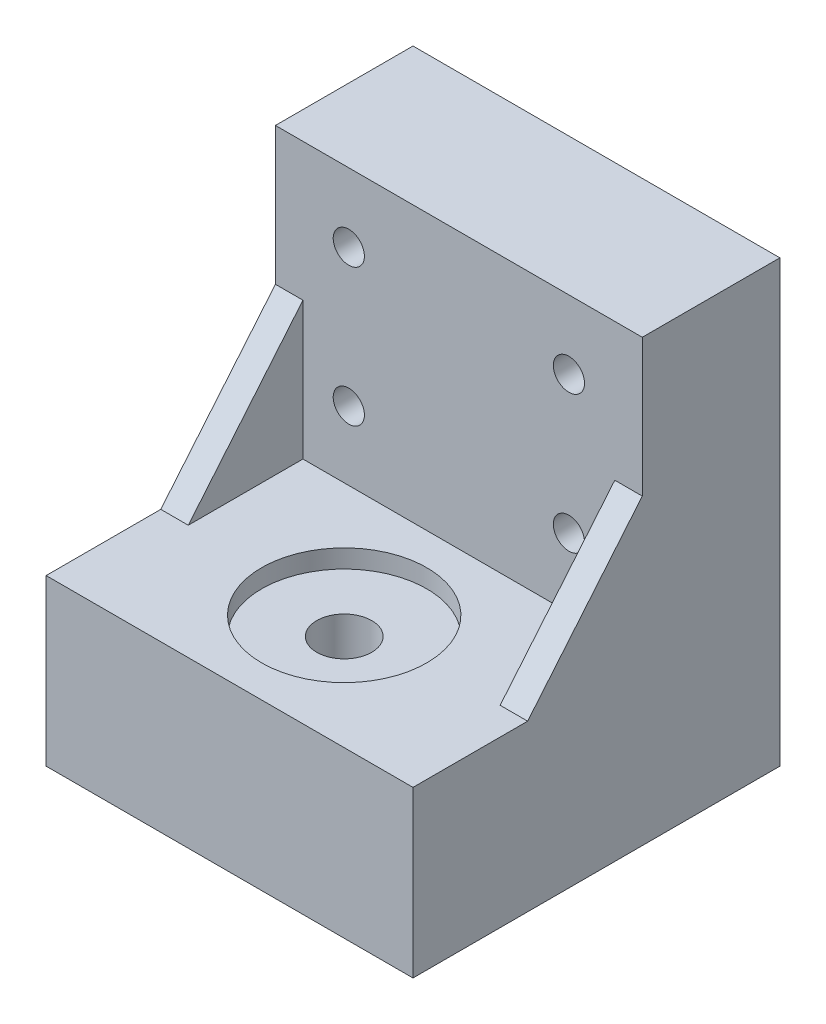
SolidWorks part; units mm, degrees
ref_plane "Front Plane" through (0, 0, 0) normal (0, 0, 1) x (1, 0, 0)
ref_plane "Top Plane" through (0, 0, 0) normal (0, 1, 0) x (1, 0, 0)
ref_plane "Right Plane" through (0, 0, 0) normal (1, 0, 0) x (0, 0, -1)
sketch "Sketch1" plane through (0, 0, 0) normal (0, 1, 0) x (1, 0, 0)
  line L1 (0, 0) -> (40, 0)
  line L2 (0, 0) -> (0, 40)
  line L3 (0, 40) -> (40, 40)
  line L4 (40, 0) -> (40, 40)
  dimension "D1" = 40
  dimension "D2" = 40
extrude "Boss-Extrude1" add sketch "Sketch1" against normal blind 18
sketch "Sketch3" plane through (0, 0, 0) normal (0, 1, 0) x (1, 0, 0)
  line L0 (40, 0) -> (40, 40) construction
  line L1 (0, 40) -> (40, 40)
  line L2 (0, 40) -> (0, 25)
  line L3 (0, 25) -> (40, 25)
  line L4 (40, 40) -> (40, 25)
  dimension "D1" = 15
extrude "Boss-Extrude2" add sketch "Sketch3" along normal blind 30
sketch "Sketch4" plane through (0, 0, 0) normal (0, 1, 0) x (1, 0, 0)
  circle A0 centre (20, 12.5) radius 9
  dimension "D1" = 18
extrude "Cut-Extrude1" cut sketch "Sketch4" against normal blind 2 contours A0
sketch "Sketch5" plane through (0, -2, 0) normal (0, 1, 0) x (1, 0, 0)
  circle A0 centre (20, 12.5) radius 3
  dimension "D1" = 6
extrude "Cut-Extrude2" cut sketch "Sketch5" against normal through all
sketch "Sketch6" plane through (0, 0, -25) normal (0, 0, 1) x (1, 0, 0)
  line L0 (0, 30) -> (0, 0) construction
  line L1 (0, 30) -> (40, 30) construction
  circle A0 centre (8, 22.5) radius 1.7
  dimension "D1" = 3.4
  dimension "D2" = 8
  dimension "D3" = 7.5
extrude "Cut-Extrude3" cut sketch "Sketch6" against normal through all
sketch "Sketch7" plane through (0, 0, -25) normal (0, 0, 1) x (1, 0, 0)
  line L1 (8, 22.5) -> (32, 22.5)
  line L2 (8, 22.5) -> (8, 7.5)
  line L3 (8, 7.5) -> (32, 7.5)
  line L4 (32, 22.5) -> (32, 7.5)
  dimension "D1" = 24
  dimension "D2" = 15
pattern_linear "LPattern1" count 2 spacing 24 along (1, 0, 0) count 2 spacing 15 along (0, -1, 0) of "Cut-Extrude3"
sketch "Sketch8" plane through (40, 0, 0) normal (1, 0, 0) x (0, 0, -1)
  line L0 (25, 15) -> (12.5, 0)
  line L1 (25, 22.5) -> (25, 7.5) construction
  line L2 (0, 0) -> (25, 0) construction
  line L3 (25, 15) -> (25, 0)
  line L4 (25, 0) -> (12.5, 0)
  point P6 (25, 0)
  point P9 (25, 0)
extrude "Boss-Extrude4" add sketch "Sketch8" against normal blind 3 contours L0 L4 L3
sketch "Sketch9" plane through (0, 0, 0) normal (-1, 0, 0) x (0, 0, 1)
  line L0 (-25, 15) -> (-12.5, 0)
  line L1 (-25, 22.5) -> (-25, 7.5) construction
  line L2 (-12.5, 0) -> (-25, 0)
  line L3 (-25, 0) -> (-25, 15)
extrude "Boss-Extrude5" add sketch "Sketch9" against normal blind 3
equation "\"Mount Width\"= 40mm"
equation "\"Feature1 Length\"= 40mm"
equation "\"Feature1 Thickness\"= 18mm"
equation "\"Feature2 Height\"= 30mm"
equation "\"Feature2 Thickness\"= 15mm"
equation "\"Bolt DIameter\"= 3.4mm"
equation "\"Horizontal Hole Spacing\"= 24mm"
equation "\"Vertical Hole Spacing\"= 15mm"
equation "\"center boss diameter\"= 18mm"
equation "\"shaft hole diameter\"= 6mm"
